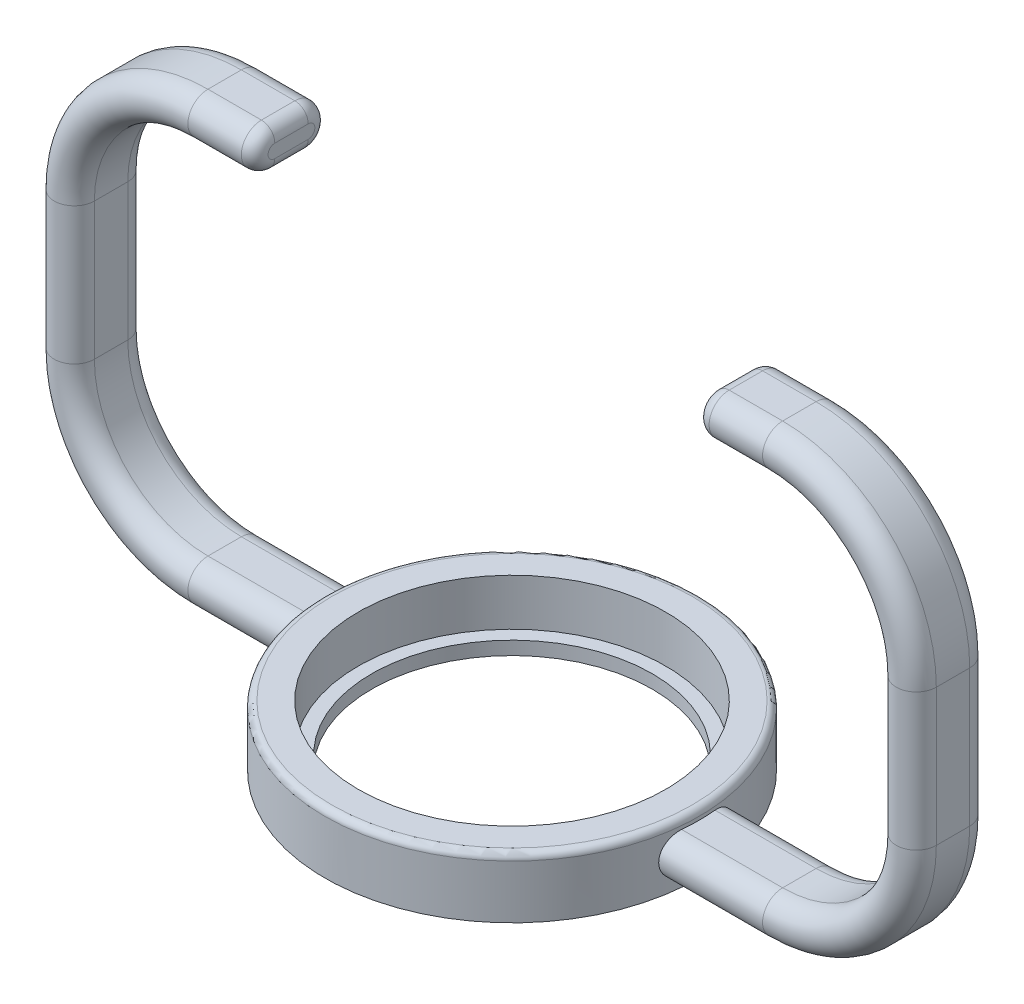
SolidWorks part; units mm, degrees
ref_plane "Front Plane" through (0, 0, 0) normal (0, 0, 1) x (1, 0, 0)
ref_plane "Top Plane" through (0, 0, 0) normal (0, 1, 0) x (1, 0, 0)
ref_plane "Right Plane" through (0, 0, 0) normal (1, 0, 0) x (0, 0, -1)
sketch "Sketch2" plane through (0, 0, 0) normal (0, 1, 0) x (1, 0, 0)
  circle A0 centre (0, 0) radius 23
  circle A1 centre (0, 0) radius 28
  dimension "D1" = 46
  dimension "D2" = 5
extrude "Boss-Extrude1" add sketch "Sketch2" along normal blind 7
sketch "Sketch3" plane through (0, 0, 0) normal (0, -1, 0) x (1, 0, 0)
  circle A0 centre (0, 0) radius 21
  circle A1 centre (0, 0) radius 23 construction
  circle A2 centre (0, 0) radius 28 construction
  circle A3 centre (0, 0) radius 28
  dimension "D1" = 2
extrude "Boss-Extrude2" add sketch "Sketch3" along normal blind 2
sketch "Sketch4" plane through (0, 0, 0) normal (1, 0, 0) x (0, 0, -1)
  line L0 (0, -2) -> (0, 63) construction
  line L1 (-28, -2) -> (28, -2) construction
  line L2 (0, 55) -> (0, -55) construction
  dimension "D1" = 65
ref_plane "Plane1" through (0, 63, 0) normal (0, 1, 0) x (1, 0, 0)
sketch "Sketch6" plane through (0, 63, 0) normal (0, 1, 0) x (1, 0, 0)
  circle A0 centre (0, 0) radius 30 construction
  dimension "D1" = 60
sketch "Sketch7" plane through (0, 0, 0) normal (0, 0, 1) x (1, 0, 0)
  line L0 (28, 2.5) -> (43, 2.5)
  line L1 (28, -2) -> (28, 7) construction
  line L2 (63, 22.5) -> (63, 43)
  line L3 (30, 63) -> (43, 63)
  arc A0 (43, 2.5) -> (63, 22.5) centre (43, 22.5) ccw
  arc A1 (43, 63) -> (63, 43) centre (43, 43) cw
  point P8 (63, 2.5)
  dimension "D2" = 20
  dimension "D1" = 35
ref_plane "Plane2" through (30, 63, 0) normal (1, 0, 0) x (0, 0, -1)
sketch "Sketch8" plane through (30, 63, 0) normal (1, 0, 0) x (0, 0, -1)
  line L0 (2.5, 0) -> (-2.5, 0) construction
  line L1 (2.5, -3) -> (-2.5, -3)
  line L2 (2.5, 3) -> (-2.5, 3)
  arc A0 (2.5, -3) -> (2.5, 3) centre (2.5, 0) ccw
  arc A1 (-2.5, 3) -> (-2.5, -3) centre (-2.5, 0) ccw
  point P2 (0, 0)
  dimension "D2" = 5
  dimension "D1" = 6
sweep "Sweep1" add profiles "Sketch8" path "Sketch7"
sketch "Sketch9" plane through (28, 0, 0) normal (-1, 0, 0) x (0, 0, 1)
  line L2 (-2.5, -0.5) -> (2.5, -0.5)
  line L3 (2.5, 5.5) -> (-2.5, 5.5)
  line L4 (-2.5, -0.5) -> (2.5, -0.5)
  line L5 (2.5, 5.5) -> (-2.5, 5.5)
  arc A2 (-2.5, 5.5) -> (-2.5, -0.5) centre (-2.5, 2.5) ccw
  arc A3 (2.5, -0.5) -> (2.5, 5.5) centre (2.5, 2.5) ccw
  arc A4 (-2.5, 5.5) -> (-2.5, -0.5) centre (-2.5, 2.5) ccw
  arc A5 (2.5, -0.5) -> (2.5, 5.5) centre (2.5, 2.5) ccw
  dimension "D1" = 0
extrude "Boss-Extrude3" add sketch "Sketch9" along normal blind 2
sketch "Sketch10" plane through (0, 66, 0) normal (0, 1, 0) x (1, 0, 0)
  line L0 (33, 10.3405) -> (33, -11.9677)
  line L1 (43, 2.5) -> (43, -2.5) construction
  dimension "D1" = 10
split "Split1" trim tools "Sketch10" bodies to split 104 resulting bodies 107
fillet "Fillet1" radius 2 4 edges at (33, 66, 0) (33, 63, -5.5) (33, 60, 0) (33, 63, 5.5)
fillet "Fillet2" radius 1 1 edges at (0, 7, 28)
mirror "Mirror3" about plane through (0, 0, 0) normal (1, 0, 0)
combine bodies "Combine1" operation type add bodies to combine 102 108 107
